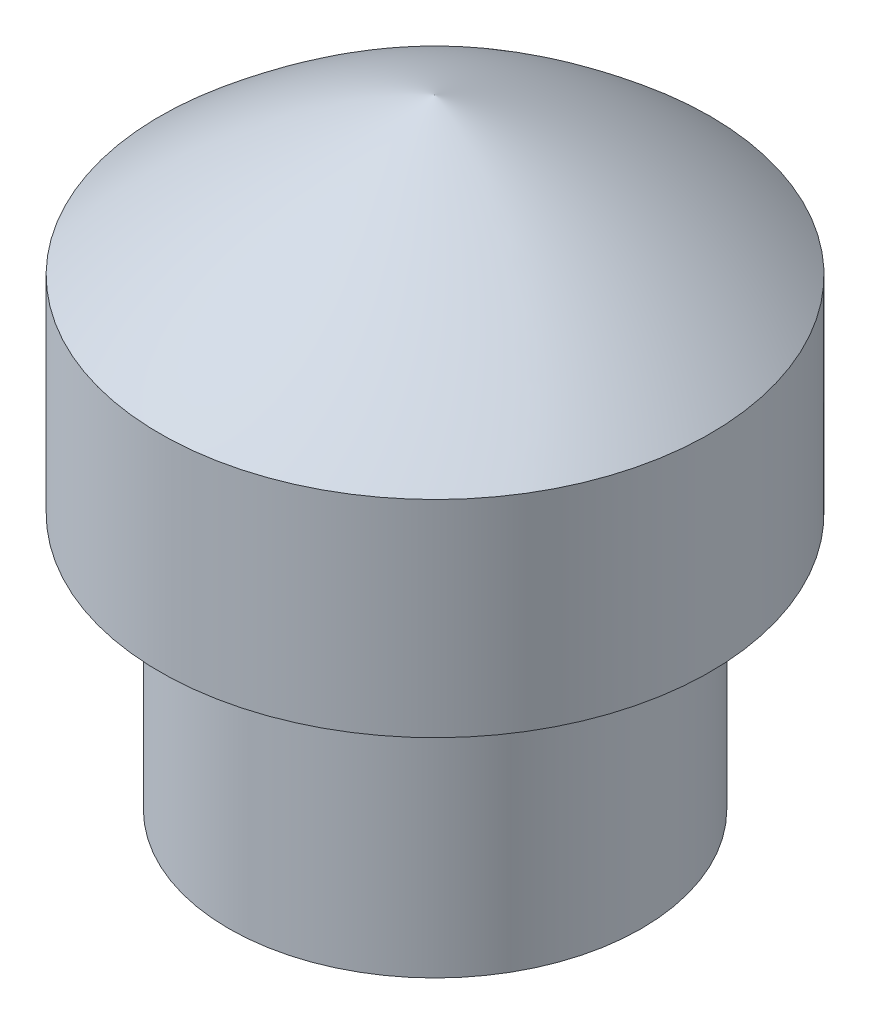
SolidWorks part; units mm, degrees
ref_plane "Front Plane" through (0, 0, 0) normal (0, 0, 1) x (1, 0, 0)
ref_plane "Top Plane" through (0, 0, 0) normal (0, 1, 0) x (1, 0, 0)
ref_plane "Right Plane" through (0, 0, 0) normal (1, 0, 0) x (0, 0, -1)
sketch "Sketch1" plane through (0, 0, 0) normal (0, 0, 1) x (1, 0, 0)
  line L0 (0, 0) -> (0, 18) construction
  line L1 (0, 0) -> (6, 0)
  line L2 (6, 0) -> (6, 7.4667)
  line L3 (6, 7.4667) -> (8, 7.4667)
  line L4 (8, 7.4667) -> (8, 13.4667)
  line L5 (0, 0) -> (0, 18)
  arc A0 (0, 18) -> (8, 13.4667) centre (-8.1151, -5.6463) cw
  dimension "D4" = 25
  dimension "D1" = 6
  dimension "D2" = 2
  dimension "D3" = 6
  dimension "D5" = 18
revolve "Revolve1" add sketch "Sketch1" angle 360 about L0
sketch "Sketch2" plane through (0, 0, 0) normal (0, -1, 0) x (1, 0, 0)
  circle A0 centre (0, 0) radius 1.5
  dimension "D1" = 3
extrude "Cut-Extrude1" cut sketch "Sketch2" against normal blind 7
